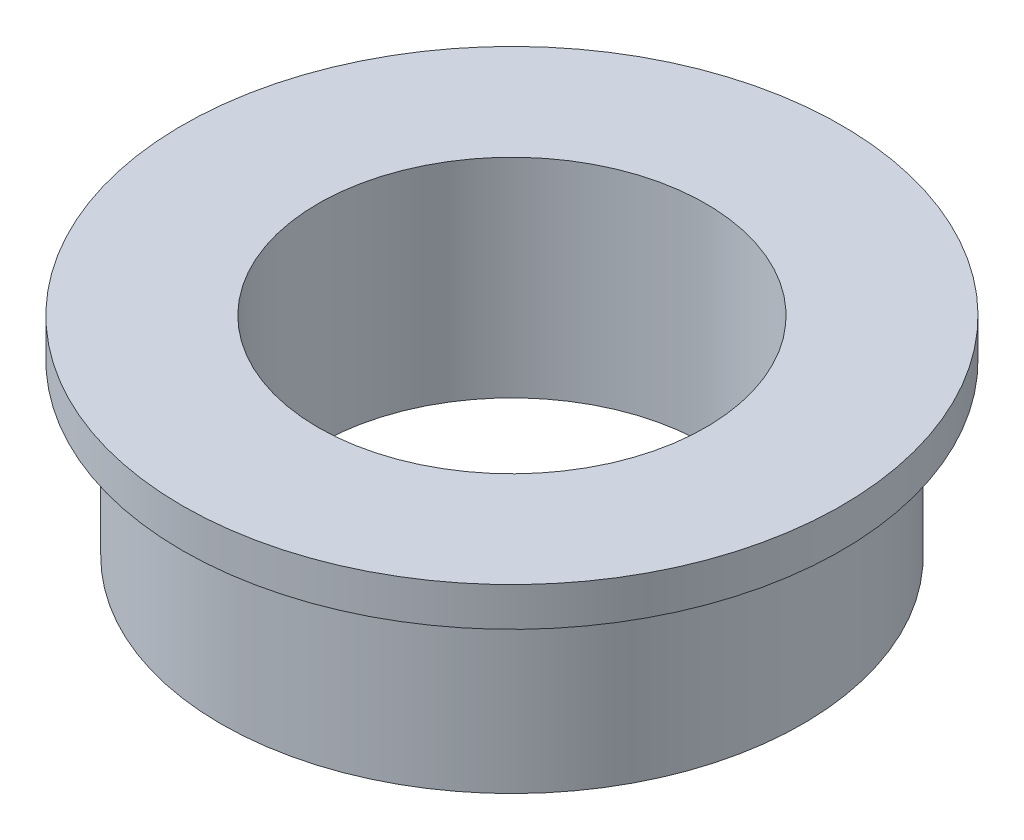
SolidWorks part; units mm, degrees
ref_plane "前视基准面" through (0, 0, 0) normal (0, 0, 1) x (1, 0, 0)
ref_plane "上视基准面" through (0, 0, 0) normal (0, 1, 0) x (1, 0, 0)
ref_plane "右视基准面" through (0, 0, 0) normal (1, 0, 0) x (0, 0, -1)
sketch "草图1" plane through (0, 0, 0) normal (0, 1, 0) x (1, 0, 0)
  circle A0 centre (0, 0) radius 6
  circle A1 centre (0, 0) radius 4
  dimension "D1" = 8
  dimension "D2" = 12
extrude "凸台-拉伸1" add sketch "草图1" along normal blind 3.5
sketch "草图2" plane through (0, 3.5, 0) normal (0, 1, 0) x (1, 0, 0)
  circle A0 centre (0, 0) radius 4
  circle A1 centre (0, 0) radius 6.8
  dimension "D1" = 8
  dimension "D2" = 13.6
extrude "凸台-拉伸2" add sketch "草图2" along normal blind 0.8
